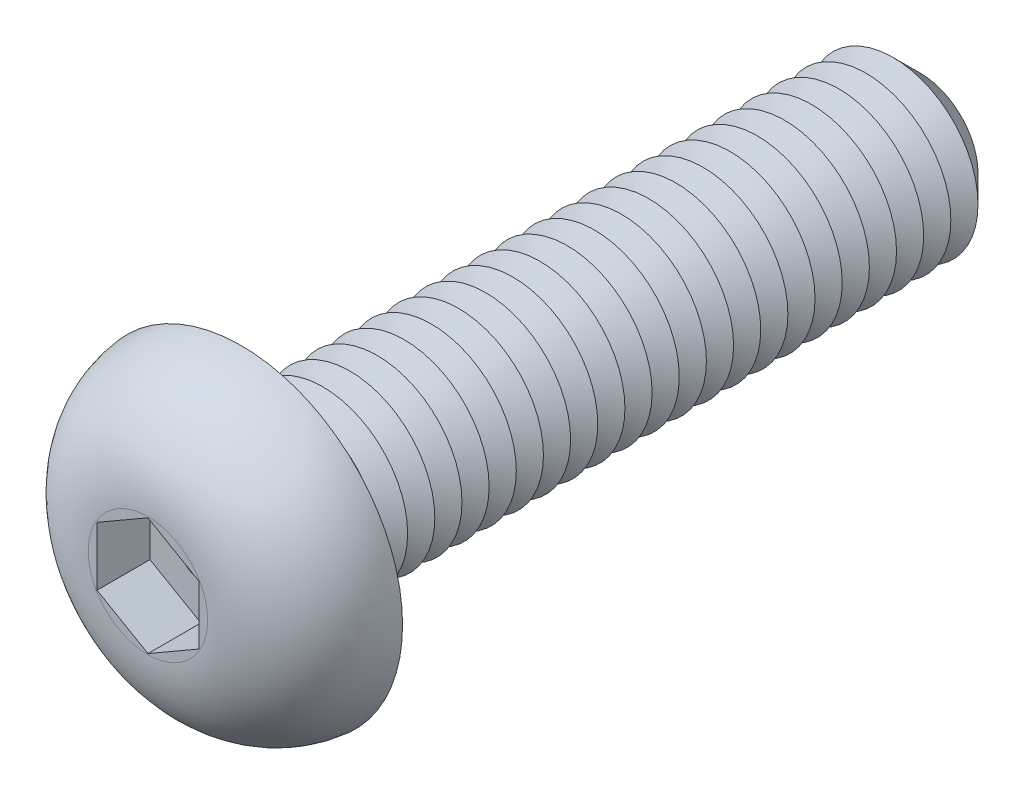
SolidWorks part; units mm, degrees
ref_plane "Front Plane" through (0, 0, 0) normal (0, 0, 1) x (1, 0, 0)
ref_plane "Top Plane" through (0, 0, 0) normal (0, 1, 0) x (1, 0, 0)
ref_plane "Right Plane" through (0, 0, 0) normal (1, 0, 0) x (0, 0, -1)
sketch "Sketch1" plane through (0, 0, 0) normal (1, 0, 0) x (0, 0, -1)
  line L0 (-47.9342, 0) -> (60.3146, 0) construction
sketch "Sketch2" plane through (0, 0, 0) normal (1, 0, 0) x (0, 0, -1)
  line L0 (0, 0) -> (-2.75, 0)
  line L1 (-47.9342, 0) -> (60.3146, 0) construction
  line L2 (-2.75, 0) -> (-2.75, 1.7604)
  line L3 (0, 4.75) -> (0, 0)
  arc A0 (-2.75, 1.7604) -> (0, 4.75) centre (0.25, 1.7604) cw
  dimension "D1" = 3
  dimension "D2" = 2.75
  dimension "D3" = 4.75
revolve "Revolve1" add sketch "Sketch2" angle 360 about L0
sketch "Sketch3" plane through (0, 0, 2.75) normal (0, 0, 1) x (1, 0, 0)
  line L1 (0, 1.7321) -> (-1.5, 0.866)
  line L2 (-1.5, 0.866) -> (-1.5, -0.866)
  line L3 (-1.5, -0.866) -> (0, -1.7321)
  line L4 (0, -1.7321) -> (1.5, -0.866)
  line L5 (1.5, -0.866) -> (1.5, 0.866)
  line L6 (1.5, 0.866) -> (0, 1.7321)
  circle A0 centre (0, 0) radius 1.5 construction
  dimension "D1" = 3
extrude "Cut-Extrude1" cut sketch "Sketch3" against normal blind 1.56
sketch "Sketch4" plane through (0, 0, 0) normal (0, 0, -1) x (-1, 0, 0)
  circle A0 centre (0, 0) radius 2.5
  dimension "D1" = 5
extrude "Boss-Extrude1" add sketch "Sketch4" along normal blind 20
chamfer "Chamfer1" distance 0.8 angle 45 1 edges at (-2.5, 0, -20)
sketch "Sketch5" plane through (0, 0, 0) normal (1, 0, 0) x (0, 0, -1)
  line L0 (0.8, 2.5) -> (1.6, 2.5)
  line L1 (19.2, 2.5) -> (0, 2.5) construction
  line L2 (1.6, 2.5) -> (1.2, 1.8072)
  line L3 (1.2, 1.8072) -> (0.8, 2.5)
  line L4 (0, -4.75) -> (0, 4.75) construction
  line L5 (19.2, 2.5) -> (0, 2.5) construction
  dimension "D1" = 0.8
  dimension "D2" = 0.8
revolve "Cut-Revolve1" cut sketch "Sketch5" angle 360 about L0
pattern_linear "LPattern1" count 23 spacing 0.8 along (0, 0, -1) of "Cut-Revolve1"
fillet "Fillet2" radius 0.4 1 edges at (2.5, 0, 0)
sketch "Sketch6" plane through (0, 0, 1.19) normal (0, 0, 1) x (1, 0, 0)
  circle A0 centre (0, 0) radius 0.65
  dimension "D1" = 1.3
extrude "Cut-Extrude2" cut sketch "Sketch6" against normal up to surface (21.19 mm away)
